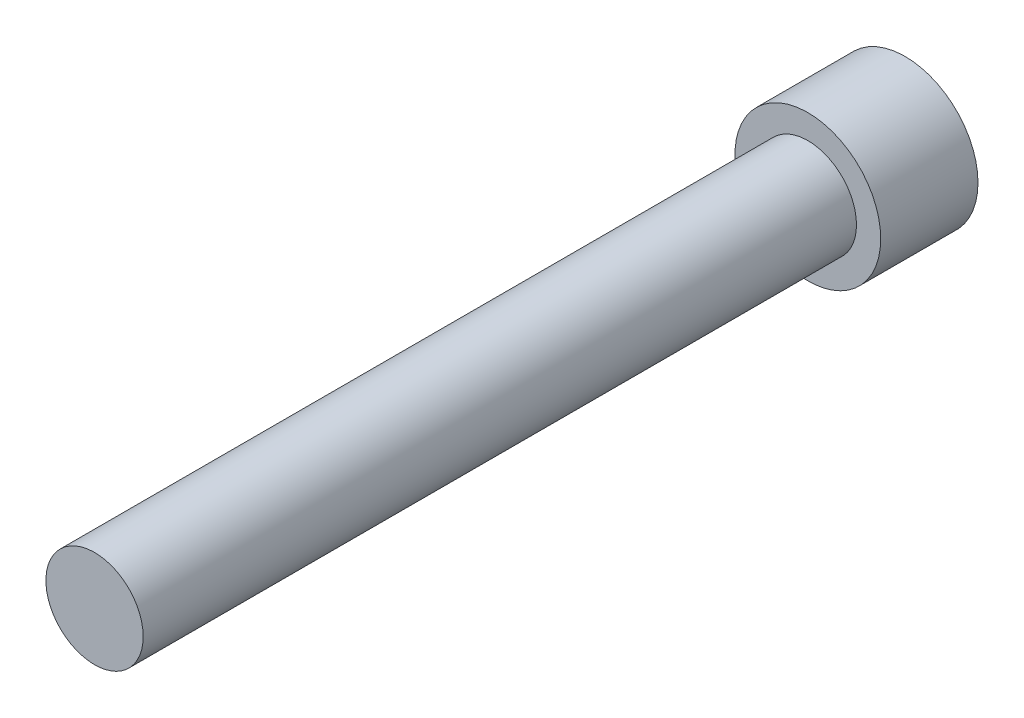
SolidWorks part; units mm, degrees
ref_plane "Front Plane" through (0, 0, 0) normal (0, 0, 1) x (1, 0, 0)
ref_plane "Top Plane" through (0, 0, 0) normal (0, 1, 0) x (1, 0, 0)
ref_plane "Right Plane" through (0, 0, 0) normal (1, 0, 0) x (0, 0, -1)
sketch "Sketch6" plane through (0, 0, 0) normal (1, 0, 0) x (0, 0, -1)
  line L0 (-69.85, 0) -> (22.525, 0) construction
  line L1 (7.8511, 0) -> (-7.8511, 0) construction
  line L2 (-69.85, 0) -> (-69.85, -4.7625)
  line L3 (-69.85, -4.7625) -> (0, -4.7625)
  line L4 (0, 7.8511) -> (0, -7.8511) construction
  line L5 (0, -4.7625) -> (0, -7.1374)
  line L6 (0, -7.1374) -> (9.525, -7.1374)
  line L7 (9.525, -7.1374) -> (9.525, 0)
  line L8 (9.525, 0) -> (-69.85, 0)
  dimension "L" = 69.85
  dimension "H" = 9.525
  dimension "A" = 14.2748
  dimension "D" = 9.525
revolve "Revolve1" add sketch "Sketch6" angle 360 about L0
sketch "Sketch7" plane through (0, 0, -9.525) normal (0, 0, -1) x (-1, 0, 0)
  line L2 (-3.9624, 2.2877) -> (-3.9624, -2.2877)
  line L4 (-3.9624, -2.2877) -> (0, -4.5754)
  line L5 (0, -4.5754) -> (3.9624, -2.2877)
  line L6 (3.9624, -2.2877) -> (3.9624, 2.2877)
  line L7 (3.9624, 2.2877) -> (0, 4.5754)
  line L8 (0, 4.5754) -> (-3.9624, 2.2877)
  circle A0 centre (0, 0) radius 3.9624 construction
  dimension "J" = 7.9248
extrude "HEX" cut sketch "Sketch7" against normal blind 5.842
